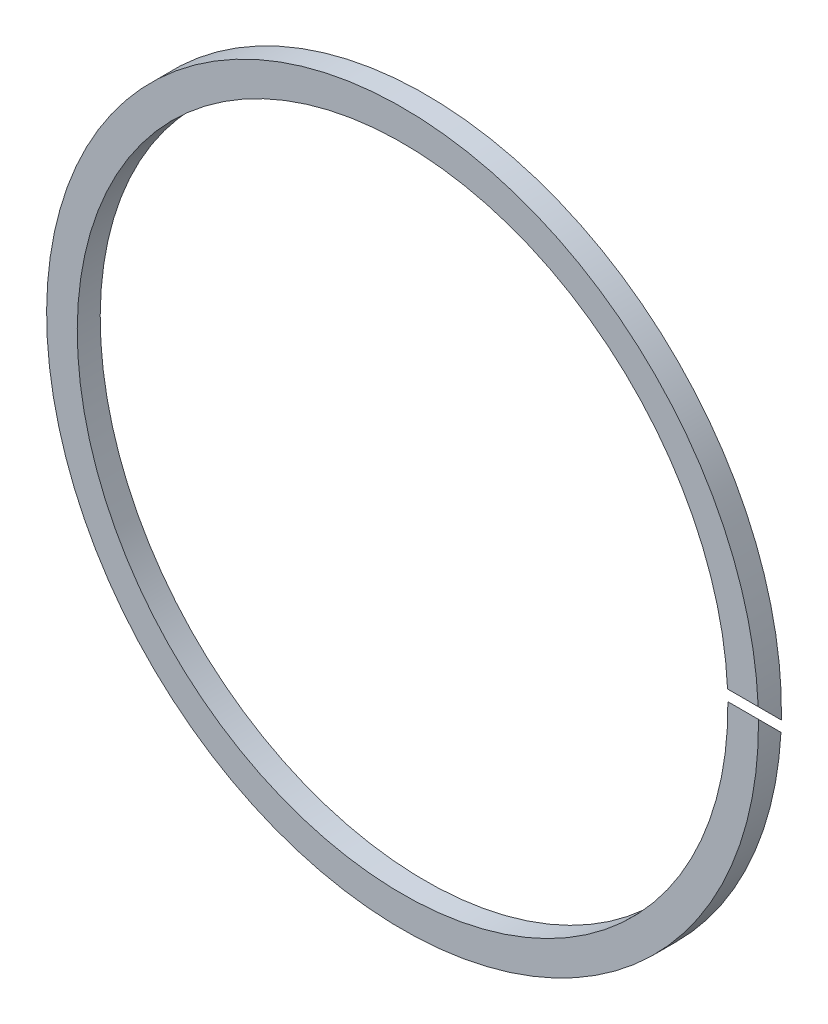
SolidWorks part; units mm, degrees
ref_plane "Front Plane" through (0, 0, 0) normal (0, 0, 1) x (1, 0, 0)
ref_plane "Top Plane" through (0, 0, 0) normal (0, 1, 0) x (1, 0, 0)
ref_plane "Right Plane" through (0, 0, 0) normal (1, 0, 0) x (0, 0, -1)
sketch "Sketch1" plane through (0, 0, 0) normal (0, 0, 1) x (1, 0, 0)
  circle A0 centre (0, 0) radius 46.5
  circle A1 centre (0, 0) radius 42.5
  dimension "D1" = 93
  dimension "D2" = 85
extrude "Boss-Extrude1" add sketch "Sketch1" along normal blind 3
ref_plane "Plane1" through (46.5, 0, 0) normal (1, 0, 0) x (0, 0, -1)
sketch "Sketch2" plane through (46.5, 0, 0) normal (1, 0, 0) x (0, 0, -1)
  line L0 (-3, 1.9516) -> (0, -1.0484)
  line L1 (-3, 46.5) -> (-3, -46.5) construction
  line L2 (0, -46.5) -> (0, 46.5) construction
  line L3 (-3, 0.5374) -> (0, -2.4626)
  line L5 (-3, 1.9516) -> (-3, 0.5374)
  line L6 (0, -1.0484) -> (0, -2.6547)
  dimension "D1" = 135
  dimension "D2" = 1
extrude "Cut-Extrude1" cut sketch "Sketch2" against normal blind 6 contours L6 L0 L5 L3
